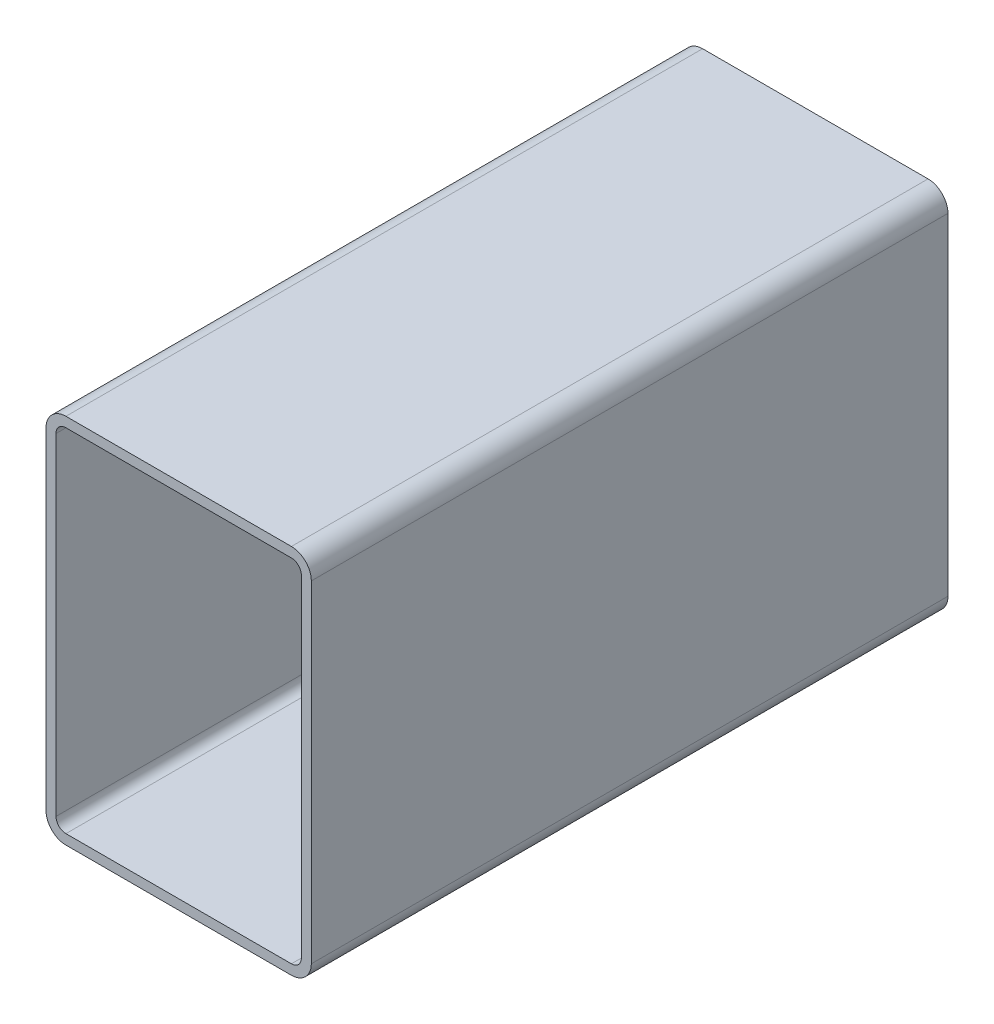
SolidWorks part; units mm, degrees
ref_plane "Front Plane" through (0, 0, 0) normal (0, 0, 1) x (1, 0, 0)
ref_plane "Top Plane" through (0, 0, 0) normal (0, 1, 0) x (1, 0, 0)
ref_plane "Right Plane" through (0, 0, 0) normal (1, 0, 0) x (0, 0, -1)
sketch "Sketch1" plane through (0, 0, 0) normal (0, 0, 1) x (1, 0, 0)
sketch_block_instance "HSS7x5x0.1875-1"
sketch_block "HSS7x5x0.1875"
extrude "Boss-Extrude1" add sketch "Sketch1" along normal blind 304.8
